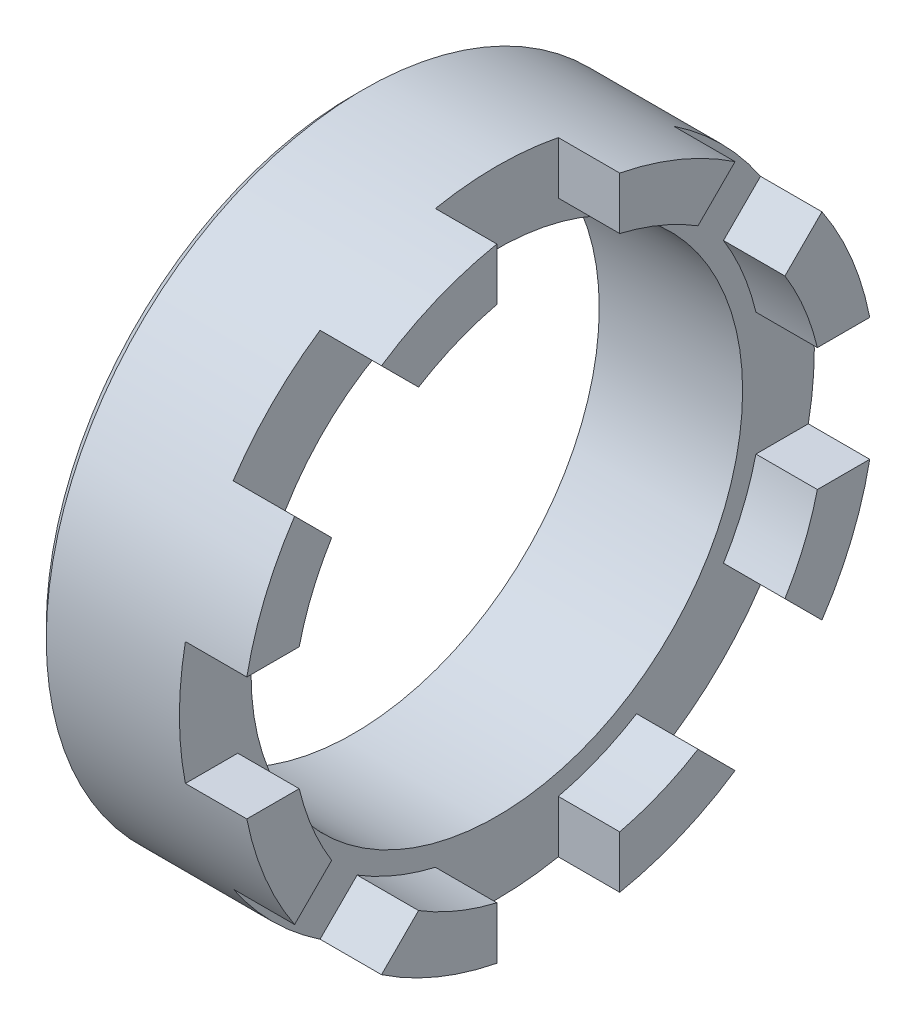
SolidWorks part; units mm, degrees
ref_plane "Plane1" through (0, 0, 0) normal (0, 0, 1) x (1, 0, 0)
ref_plane "Plane2" through (0, 0, 0) normal (0, 1, 0) x (1, 0, 0)
ref_plane "Plane3" through (0, 0, 0) normal (1, 0, 0) x (0, 0, -1)
sketch "Esquisse1" plane through (0, 0, 0) normal (0, 0, 1) x (1, 0, 0)
  line L0 (0, 12) -> (0, 15)
  line L1 (0.5, 15.5) -> (10, 15.5)
  line L2 (10, 15.5) -> (10, 13)
  line L3 (7, 12) -> (0, 12)
  line L4 (10, 13) -> (7, 13)
  line L5 (7, 13) -> (7, 12)
  line L6 (0, 15) -> (0.5, 15.5)
  line L7 (-2, 0) -> (13, 0) construction
  dimension "D1" = 15.5
  dimension "D2" = 12
revolve "Base-Révolution" add sketch "Esquisse1" angle 360 about L7
ref_plane "Plan4" through (0, 16, 0) normal (0, 1, 0) x (-1, 0, 0)
sketch "Esquisse2" plane through (0, 16, 0) normal (0, 1, 0) x (-1, 0, 0)
  line L0 (-7, -3) -> (-11, -3)
  line L2 (-7, -3) -> (-7, 3)
  line L3 (-7, 3) -> (-11, 3)
  line L4 (-11, 3) -> (-11, -3)
extrude "Enlèv. mat.-Extru.1" cut sketch "Esquisse2" against normal through all
pattern_circular "Répétition circulaire1" count 4 every 45 about axis through (-2, 0, 0) along (1, 0, 0)
